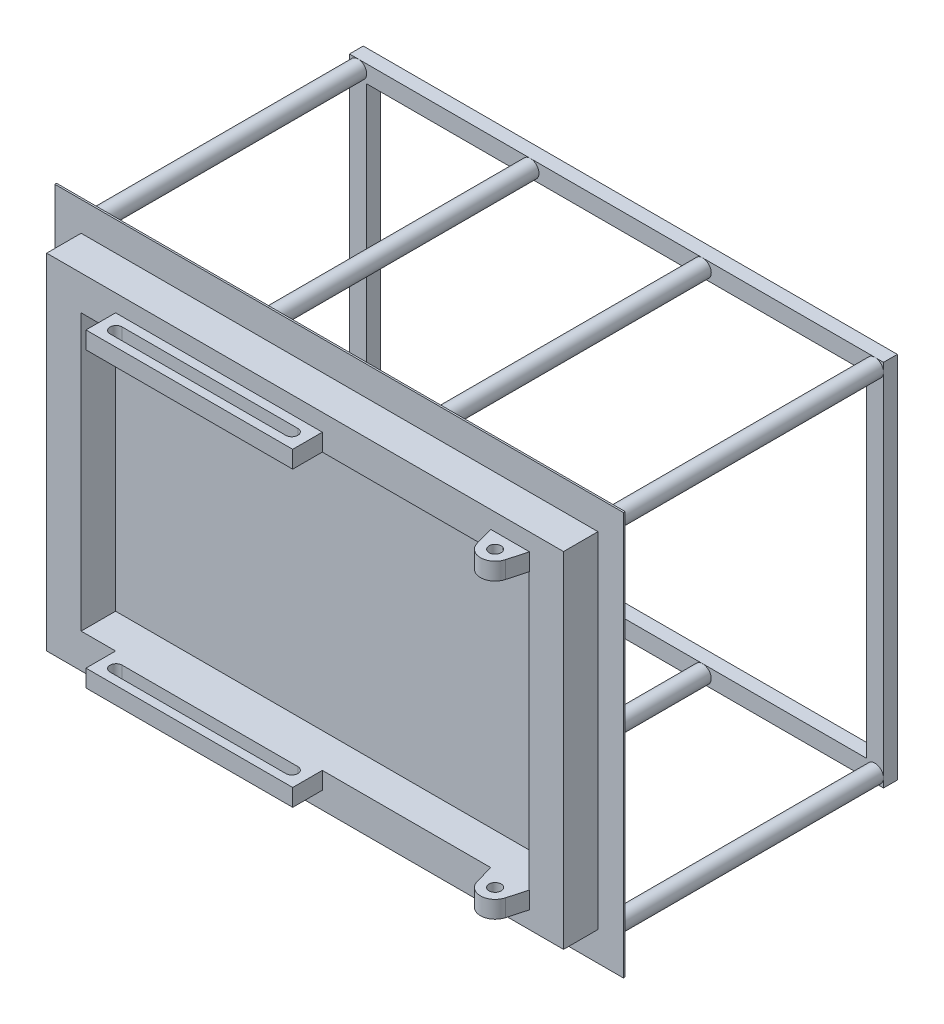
SolidWorks part; units mm, degrees
ref_plane "Plane1" through (0, 0, 0) normal (0, 0, 1) x (1, 0, 0)
ref_plane "Plane2" through (0, 0, 0) normal (0, 1, 0) x (1, 0, 0)
ref_plane "Plane3" through (0, 0, 0) normal (1, 0, 0) x (0, 0, -1)
sketch "Sketch1" plane through (0, 0, 0) normal (0, 0, 1) x (1, 0, 0)
  line L0 (-1500, 1000) -> (1500, 1000)
  line L1 (-1500, 1000) -> (-1500, -1000)
  line L2 (1500, -1000) -> (-1500, -1000)
  line L3 (1500, -1000) -> (1500, 1000)
  line L4 (-1300, 800) -> (1300, 800)
  line L5 (-1300, 800) -> (-1300, -800)
  line L6 (1300, -800) -> (-1300, -800)
  line L7 (1300, -800) -> (1300, 800)
  point P8 (-1300, 0)
  point P9 (0, -800)
  dimension "D1" = 3000
  dimension "D2" = 2000
  dimension "D3" = 200
  dimension "D4" = 200
  dimension "D5" = 200
  dimension "D6" = 200
extrude "Base-Extrude" add sketch "Sketch1" along normal mid plane 200
sketch "Sketch2" plane through (0, 0, 0) normal (0, 0, 1) x (1, 0, 0)
  line L4 (-1495, 995) -> (-1495, -995)
  line L5 (-1495, -995) -> (1495, -995)
  line L6 (1495, -995) -> (1495, 995)
  line L7 (1495, 995) -> (-1495, 995)
  line L8 (-1495, 995) -> (-1495, -995)
  line L9 (-1495, -995) -> (1495, -995)
  line L10 (1495, -995) -> (1495, 995)
  line L11 (1495, 995) -> (-1495, 995)
  line L12 (-1305, 805) -> (1305, 805)
  line L13 (-1305, 805) -> (-1305, -805)
  line L14 (1305, -805) -> (-1305, -805)
  line L15 (1305, -805) -> (1305, 805)
  line L16 (-1305, 805) -> (1305, 805)
  line L17 (-1305, 805) -> (-1305, -805)
  line L18 (1305, -805) -> (-1305, -805)
  line L19 (1305, -805) -> (1305, 805)
  dimension "D1" = 5
  dimension "D2" = 5
extrude "Cut-Extrude1" cut sketch "Sketch2" against normal mid plane 190
sketch "Sketch3" plane through (0, 800, 0) normal (0, -1, 0) x (1, 0, 0)
  line L0 (-1100, 100) -> (100, 100)
  line L1 (-1100, 100) -> (-1100, 272)
  line L2 (100, 272) -> (-1100, 272)
  line L3 (100, 272) -> (100, 100)
  line L4 (-1300, 100) -> (1300, 100) construction
  line L5 (-1010, 222) -> (10, 222)
  line L6 (-1010, 152) -> (10, 152)
  arc A0 (10, 222) -> (10, 152) centre (10, 187) cw
  arc A1 (-1010, 152) -> (-1010, 222) centre (-1010, 187) cw
  dimension "D1" = 90
  dimension "D4" = 90
  dimension "D5" = 35
  dimension "D6" = 85
  dimension "D2" = 172
  dimension "D3" = 1200
  dimension "D7" = 400
extrude "Boss-Extrude2" add sketch "Sketch3" against normal blind 100
mirror "Mirror1" about plane through (0, 0, 0) normal (0, 1, 0) of "Boss-Extrude2"
sketch "Sketch4" plane through (0, 800, 0) normal (0, -1, 0) x (1, 0, 0)
  line L0 (1302.5, 100) -> (1271.8769, 209.8293)
  line L1 (1077.5, 100) -> (1108.1231, 209.8293)
  line L2 (100, 100) -> (1300, 100) construction
  line L3 (100, 272) -> (-1100, 272) construction
  line L4 (1302.5, 100) -> (1077.5, 100)
  arc A0 (1271.8769, 209.8293) -> (1108.1231, 209.8293) centre (1190, 187) ccw
  circle A1 centre (1190, 187) radius 35
  arc A3 (10, 152) -> (10, 222) centre (10, 187) ccw construction
  arc A4 (-1010, 222) -> (-1010, 152) centre (-1010, 187) ccw construction
  dimension "D2" = 2200
  dimension "D1" = 225
extrude "Boss-Extrude3" add sketch "Sketch4" against normal blind 100
mirror "Mirror2" about plane through (0, 0, 0) normal (0, 1, 0) of "Boss-Extrude3"
sketch "Sketch5" plane through (0, 0, -100) normal (0, 0, -1) x (-1, 0, 0)
  line L0 (1652.5, 1170) -> (-1647.5, 1170)
  line L1 (1652.5, 1170) -> (1652.5, -1170)
  line L2 (-1647.5, -1170) -> (1652.5, -1170)
  line L3 (-1647.5, -1170) -> (-1647.5, 1170)
  line L4 (1500, 1000) -> (1500, -1000) construction
  line L5 (-1495, -995) -> (-1495, 995) construction
  point P4 (1652.5, 0)
  dimension "D1" = 2340
  dimension "D2" = 152.5
  dimension "D3" = 152.5
extrude "Boss-Extrude4" add sketch "Sketch5" along normal blind 10
sketch "Sketch6" plane through (0, 0, -110) normal (0, 0, -1) x (-1, 0, 0)
  line L1 (1652.5, 1170) -> (-1647.5, 1170) construction
  line L2 (1652.5, 1170) -> (1652.5, -1170) construction
  circle A0 centre (1502.5, 1020) radius 50
  dimension "D1" = 150
  dimension "D3" = 100
  dimension "D2" = 150
extrude "Boss-Extrude5" add sketch "Sketch6" along normal blind 1600
pattern_linear "LPattern1" count 4 spacing 1000 along (1, 0, 0) of "Boss-Extrude5"
pattern_linear "LPattern2" count 2 spacing 2040 along (0, -1, 0) of "Boss-Extrude5", "LPattern1"
sketch "Sketch7" plane through (0, 0, -1710) normal (0, 0, -1) x (-1, 0, 0)
  line L0 (1652.5, 1170) -> (-1647.5, 1170) construction
  line L1 (1652.5, 1170) -> (1652.5, -1170) construction
  line L2 (-1647.5, -1170) -> (1652.5, -1170) construction
  line L3 (-1647.5, -1170) -> (-1647.5, 1170) construction
  line L20 (1452.5, -970) -> (1452.5, 970)
  line L21 (1452.5, 970) -> (-1447.5, 970)
  line L22 (-1447.5, 970) -> (-1447.5, -970)
  line L23 (-1447.5, -970) -> (1452.5, -970)
  line L28 (1552.5, -1070) -> (1552.5, 1070)
  line L29 (1552.5, 1070) -> (-1547.5, 1070)
  line L30 (-1547.5, 1070) -> (-1547.5, -1070)
  line L31 (-1547.5, -1070) -> (1552.5, -1070)
  dimension "D1" = 100
  dimension "D2" = 100
  dimension "D3" = 100
  dimension "D4" = 100
  dimension "D5" = 100
  dimension "D6" = 100
  dimension "D7" = 100
  dimension "D8" = 100
extrude "Boss-Extrude6" add sketch "Sketch7" along normal blind 80
ref_point "Point1"
ref_point "Point2"
ref_point "Point3"
